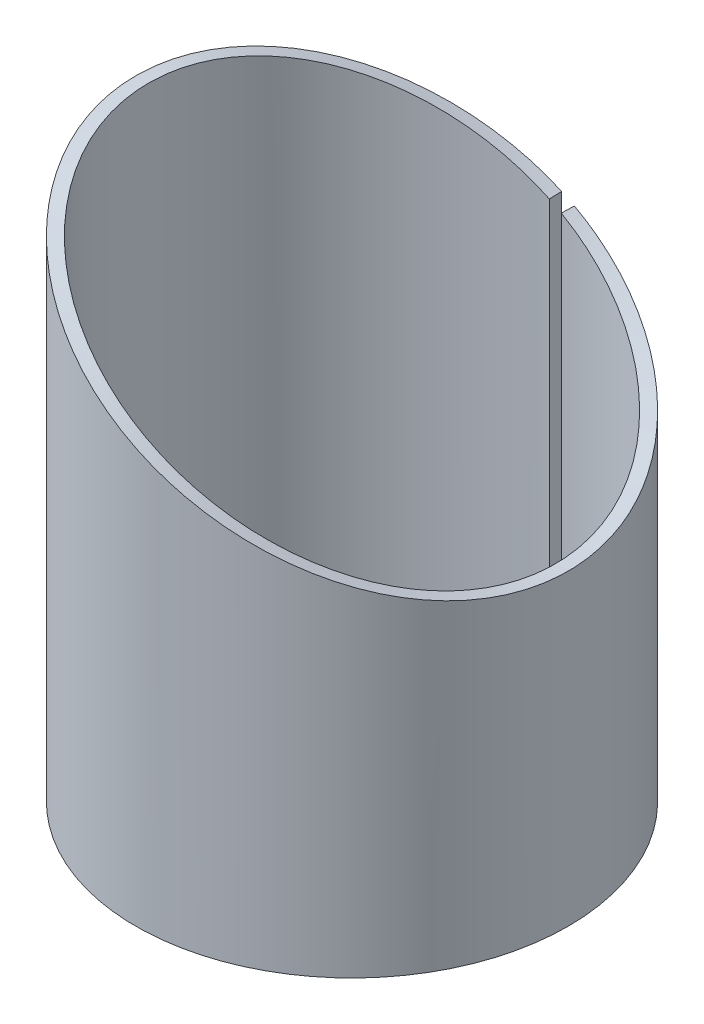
SolidWorks part; units mm, degrees
ref_plane "前视基准面" through (0, 0, 0) normal (0, 0, 1) x (1, 0, 0)
ref_plane "上视基准面" through (0, 0, 0) normal (0, 1, 0) x (1, 0, 0)
ref_plane "右视基准面" through (0, 0, 0) normal (1, 0, 0) x (0, 0, -1)
imported_body "基体零件-长短脚任意角度裤形三通管-1"
sheet metal parameters "钣金1" parameters "D1"=0.7366, "厚度"=1
bend "圆角折弯1" bend radius 15.9772 bend angle 356.625 parameters "D5"=1
flatten bends "展开-折弯1"
sketch "尖角-草图1" plane through (-43.4378, -49.0999, -16.9698) normal (-0.0295, 0, -0.9996) x (-0.9996, 0, 0.0295)
  line L0 (49.7232, 16.1432) -> (49.7232, -16.3897) construction
  dimension "D1" = 0
process bends "加工-折弯1" parameters "D1"=0
sketch "平面-草图1" plane through (-43.4378, -49.0999, -16.9698) normal (-0.0295, 0, -0.9996) x (-0.9996, 0, 0.0295)
